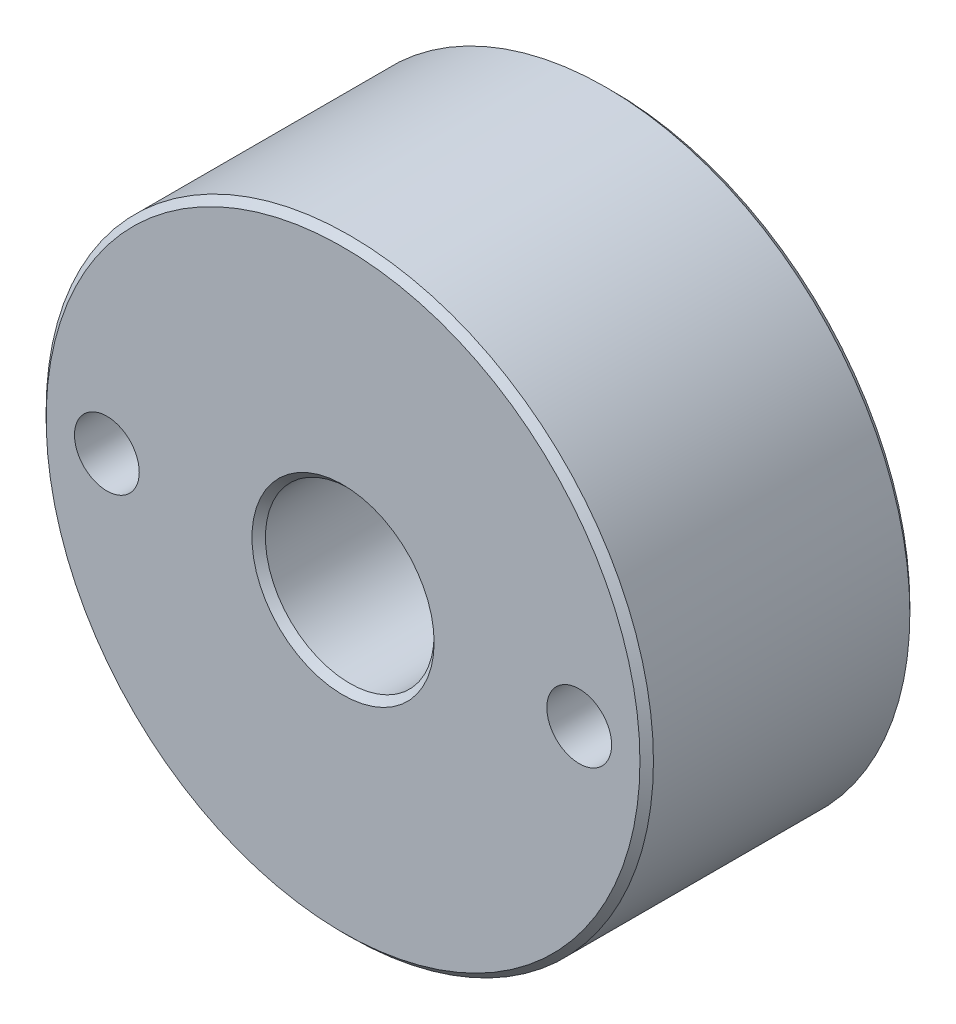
SolidWorks part; units mm, degrees
ref_plane "Face" through (0, 0, 0) normal (0, 0, 1) x (1, 0, 0)
ref_plane "Dessus" through (0, 0, 0) normal (0, 1, 0) x (1, 0, 0)
ref_plane "Droite" through (0, 0, 0) normal (1, 0, 0) x (0, 0, -1)
sketch "Esquisse1" plane through (0, 0, 0) normal (0, 0, 1) x (1, 0, 0)
  circle A0 centre (0, 0) radius 22.5
  circle A1 centre (0, 0) radius 6.25
  dimension "D1" = 45
  dimension "D2" = 12.5
extrude "Extrusion1" add sketch "Esquisse1" along normal blind 20
hole_wizard "Trou taraudé M6x1.02" positions "Esquisse5" profile "Esquisse4" tap size "M6x1.0" standard "ISO"
sketch "Esquisse5" plane through (0, 0, 20) normal (0, 0, 1) x (1, 0, 0)
  line L0 (28.8386, 0) -> (-26.0133, 0)
  point P0 (-17.5, 0)
  point P1 (17.5, 0)
  dimension "D1" = 35
  dimension "D2" = 17.5
sketch "Esquisse4" plane through (-17.5, 0, 20) normal (1, 0, 0) x (0, -1, 0)
  line L0 (0, 0) -> (0, 20)
  line L1 (0, 20) -> (2.4, 20)
  line L2 (2.4, 20) -> (2.4, 0)
  line L5 (2.4, 0) -> (0, 0)
  line L11 (0, -6.35) -> (0, 107.95) construction
  dimension "Diamètre du trou pour taraudage jusqu'au prochain" = 4.8
  dimension "Profondeur du trou pour taraudage jusqu'au prochain" = 20
chamfer "Chanfrein2" distance 0.5 angle 45
